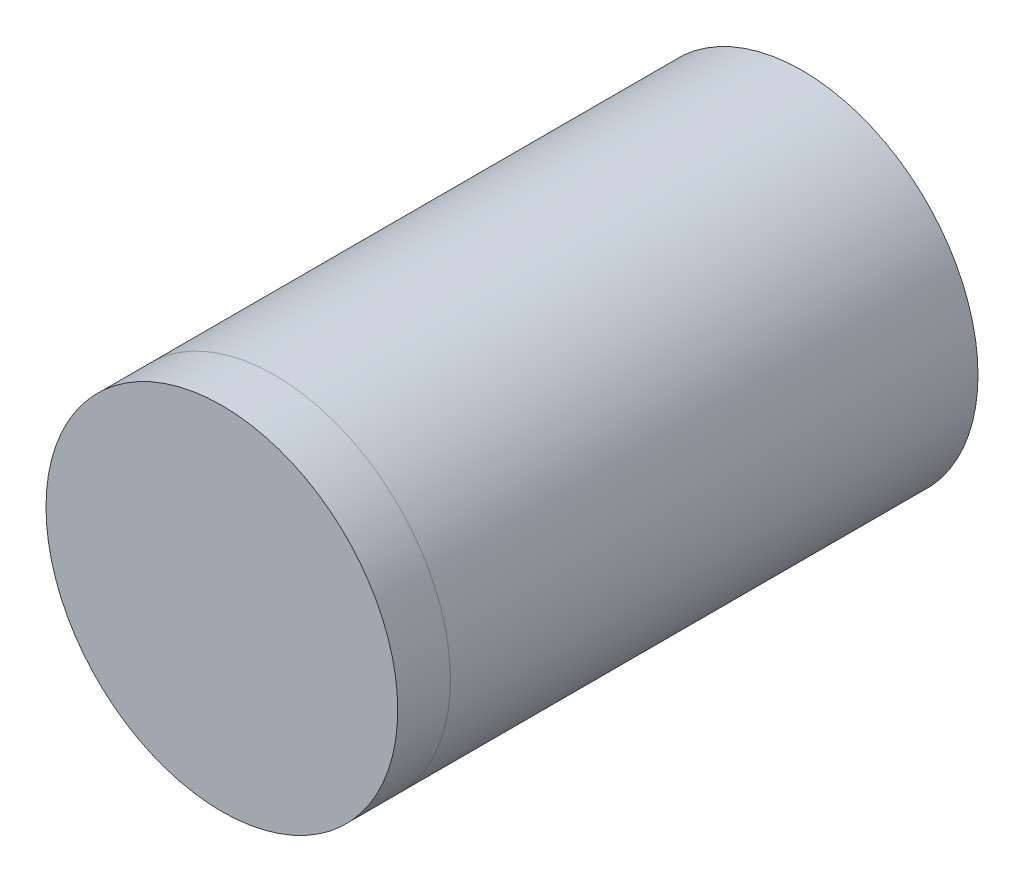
SolidWorks part; units mm, degrees
ref_plane "Plan1" through (0, 0, 0) normal (0, 0, 1) x (1, 0, 0)
ref_plane "Plan2" through (0, 0, 0) normal (0, 1, 0) x (1, 0, 0)
ref_plane "Plan3" through (0, 0, 0) normal (1, 0, 0) x (0, 0, -1)
sketch "EsquisseCorps" plane through (0, 0, 0) normal (0, 1, 0) x (1, 0, 0)
  line L0 (0, 0) -> (0, -16.499) construction
  line L1 (0, -14.999) -> (5.0005, -14.999)
  line L2 (0, -14.999) -> (0, -16.499)
  line L3 (0, -16.499) -> (5.0005, -16.499)
  line L4 (5.0005, -14.999) -> (5.0005, -16.499)
  dimension "LongueurHorsBroche" = 16.499
  dimension "LongueurCorps" = 1.5
  dimension "RayonCorps" = 5.0005
revolve "Base-Révolution" add sketch "EsquisseCorps" angle 360 about L0
sketch "Esquisse1" plane through (0, 0, 0) normal (0, 1, 0) x (1, 0, 0)
  line L0 (0, 0.001) -> (0, -14.999) construction
  line L1 (0, 0.001) -> (5, 0.001)
  line L2 (0, 0.001) -> (0, -14.999)
  line L3 (0, -14.999) -> (5, -14.999)
  line L4 (5, 0.001) -> (5, -14.999)
  line L5 (0, 12.3484) -> (0, -19.1197) construction
  dimension "Rayon" = 5
  dimension "LongueurUtile" = 15
  dimension "SurLongueur" = 0.001
revolve "Boss.-Révol.1" add sketch "Esquisse1" angle 360 about L0
sketch "Esquisse2" [suppressed] plane through (0, 0, 0) normal (0, 1, 0) x (1, 0, 0)
  line L0 (0, -12) -> (0, 7.4067)
  line L2 (20, -12) -> (0, -12)
  line L3 (0, 0) -> (0, -20) construction
  line L4 (0, 7.4067) -> (5.8225, 7.4067)
  line L5 (20, -10) -> (20, -12)
  line L6 (0, 0) -> (0, -12) construction
  line L7 (5.8225, 7.4067) -> (20, -10)
  dimension "LongueurUtile" = 19.4067
  dimension "Rayon2" = 20
  dimension "Rayon1" = 5.8225
  dimension "SurLongueur" = 7.4067
  dimension "LongueurCyl" = 2
revolve "Boss.-Révol.2" [suppressed] add sketch "Esquisse2" angle 360 about L6
sketch "Esquisse3" [suppressed] plane through (0, 0, 0) normal (0, 1, 0) x (1, 0, 0)
  line L0 (15, -10.438) -> (15, -14.0265)
  line L1 (0, 0) -> (0, -20) construction
  line L2 (0, 4.562) -> (0, -14.0265)
  line L3 (0, -14.0265) -> (15, -14.0265)
  line L4 (0, 4.562) -> (0, -14.0265) construction
  arc A0 (15, -10.438) -> (0, 4.562) centre (0, -10.438) ccw
  dimension "LongueurUtile" = 18.5885
  dimension "Rayon1" = 15
  dimension "SurLongueur" = 4.562
revolve "Boss.-Révol.3" [suppressed] add sketch "Esquisse3" angle 360 about L4
sketch "Esquisse4" [suppressed] plane through (0, 0, 0) normal (0, 1, 0) x (1, 0, 0)
  line L0 (0, -11.9602) -> (0, 1.9611)
  line L1 (0, 1.9611) -> (10.7931, 1.9611)
  line L2 (0, -11.9602) -> (10.7931, -11.9602)
  line L5 (0, 0) -> (0, -12.8248) construction
  arc A0 (10.7931, 1.9611) -> (10.7931, -11.9602) centre (10.7931, -4.9996) cw
  dimension "Rayon2" = 6.9606
  dimension "Rayon1" = 10.7931
  dimension "SurLongueur" = 1.9611
revolve "Boss.-Révol.4" [suppressed] add sketch "Esquisse4" angle 360 about L5
sketch "Esquisse5" [suppressed] plane through (0, 0, 0) normal (0, 1, 0) x (1, 0, 0)
  line L0 (0, 0) -> (0, -15.295)
  line L1 (0, 0) -> (0, -20) construction
  line L2 (0, 0) -> (6.1156, 0)
  line L3 (0, -15.295) -> (11.1156, -15.295)
  line L4 (11.1156, -15.295) -> (11.1156, -5)
  line L5 (0, -15.295) -> (0, 0) construction
  arc A0 (11.1156, -5) -> (6.1156, 0) centre (6.1156, -5) ccw
  dimension "Rayon2" = 5
  dimension "LongueurUtile" = 15.295
  dimension "Rayon1" = 11.1156
revolve "Boss.-Révol.5" [suppressed] add sketch "Esquisse5" angle 360 about L5
sketch "Esquisse6" [suppressed] plane through (0, 0, 0) normal (0, 1, 0) x (1, 0, 0)
  line L0 (0, -12.8875) -> (0, 5.1125)
  line L1 (0, 5.1125) -> (10.2661, 5.1125)
  line L2 (16.689, -3.8875) -> (10.2661, -12.8875)
  line L3 (10.2661, -12.8875) -> (0, -12.8875)
  line L4 (10.2661, 5.1125) -> (16.689, -3.8875)
  line L5 (0, 0) -> (0, -12.8875) construction
  dimension "LongueurUtile" = 18
  dimension "Rayon1" = 16.689
  dimension "Rayon2" = 10.2661
  dimension "DemiLongueur" = 9
  dimension "SurLongueur" = 5.1125
  dimension "Rayon3" = 10.2661
revolve "Boss.-Révol.6" [suppressed] add sketch "Esquisse6" angle 360 about L5
sketch "Esquisse7" [suppressed] plane through (0, 0, 0) normal (0, 1, 0) x (1, 0, 0)
  line L0 (0, 0) -> (2.1898, -1.2643)
  line L1 (2.1898, -1.2643) -> (2.1898, -3.8966)
  line L2 (2.1898, -3.8966) -> (7.0523, -12.3186)
  line L3 (0, 0) -> (0, -15.8125)
  line L4 (0, 0) -> (0, -20) construction
  line L5 (0, -10) -> (0, -20) construction
  line L6 (0, 0) -> (0, -15.8125) construction
  line L7 (0, -15.8125) -> (7.0523, -15.8125)
  line L8 (7.0523, -15.8125) -> (7.0523, -12.3186)
  dimension "Angle1" = 60
  dimension "Angle2" = 30
  dimension "LongueurUtile" = 15.8125
  dimension "Rayon2" = 2.1898
  dimension "Rayon1" = 7.0523
  dimension "LongueurCyl" = 3.4939
revolve "Boss.-Révol.7" [suppressed] add sketch "Esquisse7" angle 360 about L6
sketch "EsquisseADCYL" [suppressed] plane through (0, 0, 0) normal (0, 1, 0) x (1, 0, 0)
  line L0 (0, -19.99) -> (12.5, -19.99)
  line L1 (0, 0) -> (0, -55) construction
  line L2 (12.5, -19.99) -> (12.5, -35)
  line L3 (12.5, -35) -> (15, -35)
  line L4 (15, -35) -> (15, -45)
  line L5 (15, -45) -> (0, -45)
  line L6 (0, -45) -> (0, -19.99)
  line L7 (0, 0) -> (0, -45) construction
  dimension "Longueur1" = 15.01
  dimension "Longueur2" = 10
  dimension "Rayon1" = 12.5
  dimension "Rayon2" = 15
  dimension "Position" = 19.99
revolve "Adaptateur-Cylindrique" [suppressed] add sketch "EsquisseADCYL" angle 360 about L7
sketch "EsquisseADCONE" [suppressed] plane through (0, 0, 0) normal (0, 1, 0) x (1, 0, 0)
  line L0 (0, -19.99) -> (12.5, -19.99)
  line L1 (0, 0) -> (0, -55) construction
  line L2 (12.5, -19.99) -> (15, -35)
  line L3 (15, -35) -> (15, -45)
  line L4 (15, -45) -> (0, -45)
  line L5 (0, -45) -> (0, -19.99)
  line L6 (0, 0) -> (0, -45) construction
  dimension "Rayon1" = 12.5
  dimension "Rayon2" = 15
  dimension "Longueur2" = 10
  dimension "Longueur1" = 15.01
  dimension "Position" = 19.99
revolve "Adaptateur-Conique" [suppressed] add sketch "EsquisseADCONE" angle 360 about L6
sketch "EsquisseATCYL" [suppressed] plane through (0, 0, 0) normal (0, 1, 0) x (1, 0, 0)
  line L0 (0, -44.9) -> (20, -44.9)
  line L1 (0, 0) -> (0, -55) construction
  line L2 (20, -44.9) -> (20, -64.91)
  line L3 (20, -64.91) -> (25, -64.91)
  line L4 (25, -64.91) -> (25, -84.91)
  line L5 (25, -84.91) -> (0, -84.91)
  line L6 (0, -84.91) -> (0, -44.9)
  line L7 (0, -84.91) -> (0, 0) construction
  dimension "Rayon1" = 20
  dimension "Rayon2" = 25
  dimension "Longueur1" = 20.01
  dimension "Longueur2" = 20
  dimension "Position" = 44.9
revolve "Attachement-Cylindrique" [suppressed] add sketch "EsquisseATCYL" angle 360 about L7
sketch "EsquisseATCONE" [suppressed] plane through (0, 0, 0) normal (0, 1, 0) x (1, 0, 0)
  line L0 (0, -24.3219) -> (7.3421, -24.3219)
  line L1 (0, 0) -> (0, -55) construction
  line L2 (7.3421, -24.3219) -> (13.3823, -31.8202)
  line L3 (13.3823, -31.8202) -> (13.3823, -41.193)
  line L4 (13.3823, -41.193) -> (0, -41.193)
  line L5 (0, -41.193) -> (0, -24.3219)
  line L6 (0, -41.193) -> (0, 0) construction
  dimension "Rayon1" = 7.3421
  dimension "Rayon2" = 13.3823
  dimension "Longueur1" = 7.4983
  dimension "Longueur2" = 9.3728
  dimension "Position" = 24.3219
revolve "Attachement-Conique" [suppressed] add sketch "EsquisseATCONE" angle 360 about L6
